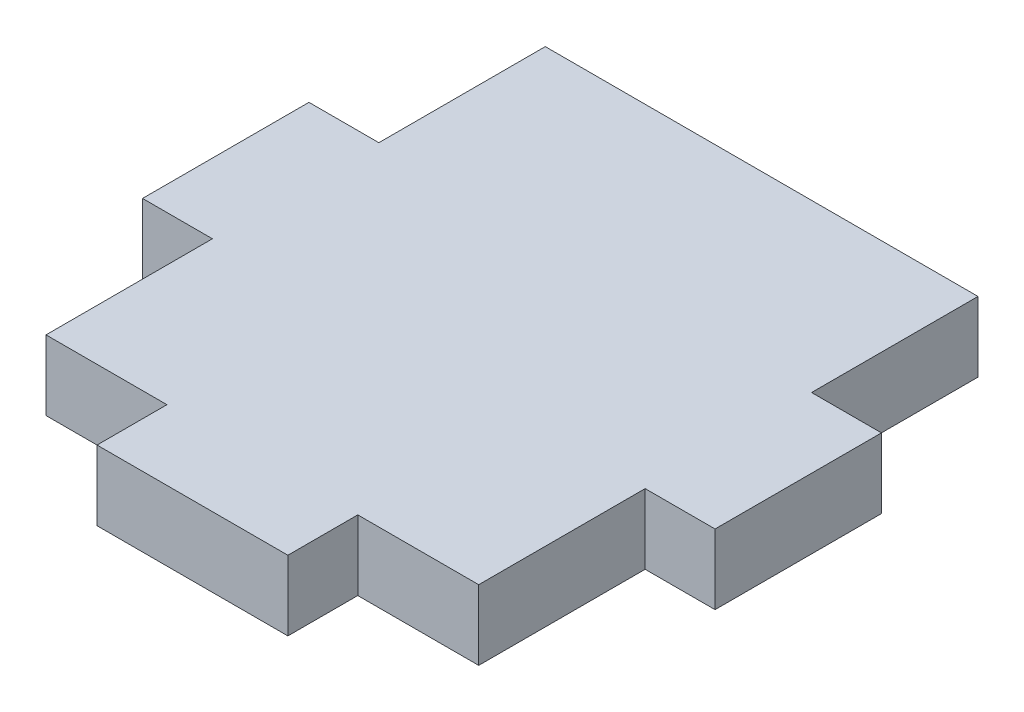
SolidWorks part; units mm, degrees
ref_plane "Front Plane" through (0, 0, 0) normal (0, 0, 1) x (1, 0, 0)
ref_plane "Top Plane" through (0, 0, 0) normal (0, 1, 0) x (1, 0, 0)
ref_plane "Right Plane" through (0, 0, 0) normal (1, 0, 0) x (0, 0, -1)
sketch "Sketch1" plane through (0, 0, 0) normal (0, 1, 0) x (1, 0, 0)
  line L1 (-16.51, -19.05) -> (16.51, -19.05)
  line L2 (-16.51, -19.05) -> (-16.51, 19.05)
  line L3 (-16.51, 19.05) -> (16.51, 19.05)
  line L4 (16.51, -19.05) -> (16.51, 19.05)
  line L5 (-16.51, -19.05) -> (16.51, 19.05) construction
  line L6 (-16.51, 19.05) -> (16.51, -19.05) construction
  point P0 (0, 0)
  dimension "D1" = 38.1
  dimension "D2" = 33.02
extrude "Boss-Extrude1" add sketch "Sketch1" along normal mid plane 5.334
sketch "Sketch2" plane through (0, 2.667, 0) normal (0, 1, 0) x (1, 0, 0)
  line L0 (-16.51, -19.05) -> (16.51, -19.05) construction
  line L1 (-7.2813, -19.05) -> (7.2813, -19.05)
  line L2 (-7.2813, -19.05) -> (-7.2813, -24.384)
  line L3 (-7.2813, -24.384) -> (7.2813, -24.384)
  line L4 (7.2813, -19.05) -> (7.2813, -24.384)
  line L5 (-21.844, -6.35) -> (-21.844, -19.05) construction
  line L6 (7.2813, -19.05) -> (21.844, -19.05) construction
  line L7 (-16.51, 19.05) -> (-16.51, -19.05) construction
  line L8 (-16.51, -6.35) -> (-21.844, -6.35)
  line L9 (-16.51, -6.35) -> (-16.51, 6.35)
  line L10 (-16.51, 6.35) -> (-21.844, 6.35)
  line L11 (-21.844, -6.35) -> (-21.844, 6.35)
  line L12 (-16.51, 19.05) -> (-16.51, 6.35) construction
  line L13 (-16.51, -6.35) -> (-16.51, -19.05) construction
  line L14 (0, 19.05) -> (0, -19.05) construction
  line L15 (16.51, 19.05) -> (-16.51, 19.05) construction
  line L16 (21.844, -6.35) -> (21.844, 6.35)
  line L17 (16.51, 6.35) -> (21.844, 6.35)
  line L18 (16.51, -6.35) -> (16.51, 6.35)
  line L19 (16.51, -6.35) -> (21.844, -6.35)
  line L20 (21.844, -19.05) -> (21.844, -6.35) construction
  line L21 (-21.844, -19.05) -> (-16.51, -19.05) construction
  dimension "D1" = 5.334
  dimension "D2" = 5.334
extrude "Boss-Extrude2" add sketch "Sketch2" against normal blind 5.334
equation "\"D1@Boss-Extrude1\"=\"material\""
equation "\"D1@Boss-Extrude2\"=\"material\""
equation "\"material\"=\"MDF@Platform.assembly\""
